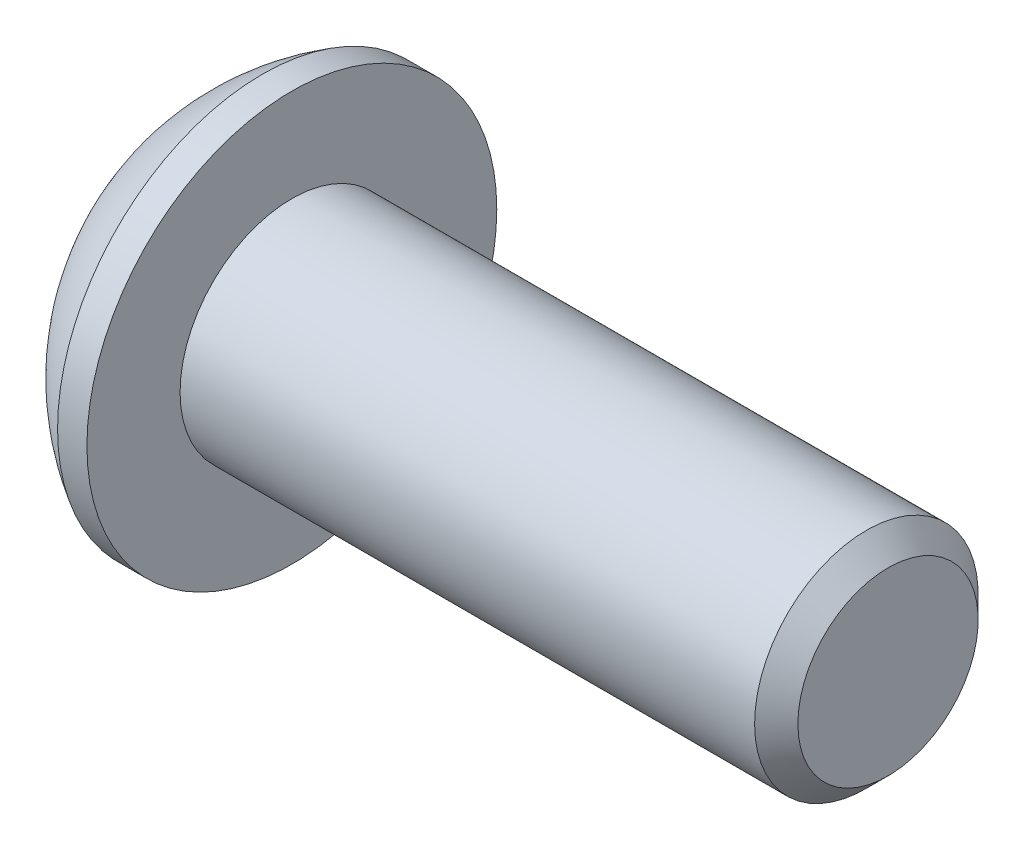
SolidWorks part; units mm, degrees
ref_plane "Plane1" through (0, 0, 0) normal (0, 0, 1) x (1, 0, 0)
ref_plane "Plane2" through (0, 0, 0) normal (0, 1, 0) x (1, 0, 0)
ref_plane "Plane3" through (0, 0, 0) normal (1, 0, 0) x (0, 0, -1)
sketch "BodySke" plane through (0, 0, 0) normal (0, 0, 1) x (1, 0, 0)
  line L0 (19.3528, 0) -> (19.3528, 2.4193)
  line L1 (18.7721, 3) -> (3.3528, 3)
  line L2 (3.3528, 3) -> (3.3528, 5.5)
  line L3 (3.3528, 5.5) -> (2.5654, 5.5)
  line L4 (0, 0) -> (101.6, 0) construction
  line L5 (3.3528, -5.5) -> (2.5654, -5.5) construction
  line L6 (55.6768, -3) -> (3.3528, -3) construction
  line L7 (19.3528, 0) -> (0, 0)
  line L8 (0, 2.75) -> (0, -2.75) construction
  line L9 (0, 0) -> (0, 2.75)
  line L10 (19.3528, 2.4193) -> (18.7721, 3)
  line L11 (19.3528, -2.4193) -> (18.7721, -3) construction
  line L12 (4.6228, 9.525) -> (4.6228, -3) construction
  line L13 (3.4778, 9.525) -> (3.4778, -3) construction
  arc A1 (0, 2.75) -> (2.5654, 5.5) centre (5.7045, 0) cw
  dimension "D1" = 5.5
  dimension "Diameter" = 6
  dimension "Length" = 16
  dimension "Head_dia" = 11
  dimension "Head_ht" = 3.3528
  dimension "Head_side_ht" = 0.7874
  dimension "Minor_dia" = 4.8387
  dimension "Body_ch_ang" = 45
  dimension "Advance" = 1.27
  dimension "Thread_nom" = 15.875
revolve "BaseBody" add sketch "BodySke" angle 360 about L4
sketch "Sketch2" plane through (0, 0, 0) normal (0, 0, 1) x (1, 0, 0)
  line L0 (0, 1.9812) -> (2.2098, 1.9812)
  line L1 (2.2098, 1.9812) -> (3.3536, 0)
  line L3 (3.3536, 0) -> (0, 0)
  line L4 (0, 0) -> (0, 1.9812)
  line L5 (0, -1.9812) -> (2.2098, -1.9812) construction
  line L6 (0, 0) -> (47.625, 0) construction
  dimension "D2" = 60
  dimension "PreBroach_depth" = 2.2098
  dimension "PreBroach_dia" = 3.9624
revolve "PreBroach" cut sketch "Sketch2" angle 360 about L6
sketch "Sketch3" plane through (0, 0, 0) normal (1, 0, 0) x (0, 0, -1)
  line L0 (-2, -1.1547) -> (-2, 1.1547)
  line L1 (-2, 1.1547) -> (0, 2.3094)
  line L2 (0, 2.3094) -> (2, 1.1547)
  line L3 (2, 1.1547) -> (2, -1.1547)
  line L4 (2, -1.1547) -> (0, -2.3094)
  line L5 (0, -2.3094) -> (-2, -1.1547)
  dimension "D1" = 2
  dimension "D2" = 2
  dimension "D3" = 4
  dimension "Hex_size" = 4
extrude "Hex" cut sketch "Sketch3" along normal blind 2.2098
